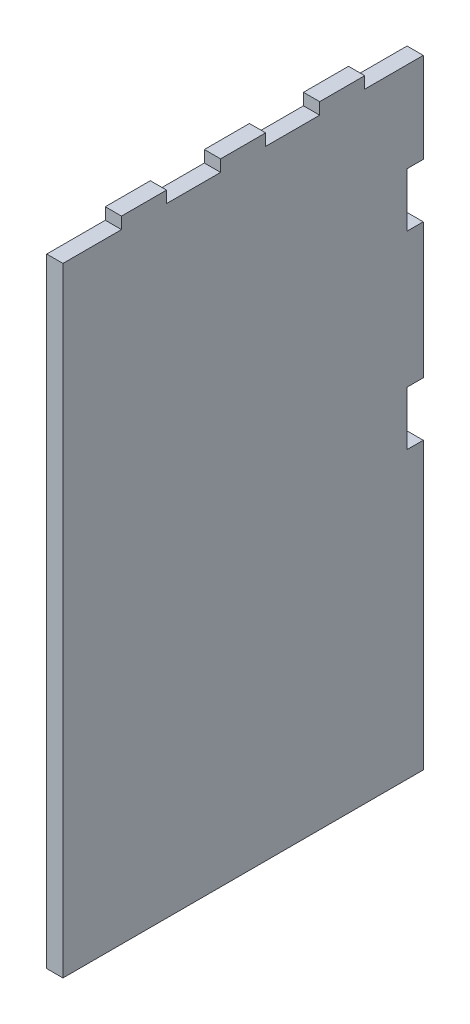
SolidWorks part; units mm, degrees
ref_plane "Front Plane" through (0, 0, 0) normal (0, 0, 1) x (1, 0, 0)
ref_plane "Top Plane" through (0, 0, 0) normal (0, 1, 0) x (1, 0, 0)
ref_plane "Right Plane" through (0, 0, 0) normal (1, 0, 0) x (0, 0, -1)
sketch "Sketch1" plane through (0, 0, 0) normal (1, 0, 0) x (0, 0, -1)
  line L1 (200, -350) -> (-200, -350)
  line L2 (200, -350) -> (200, 350)
  line L3 (200, 350) -> (-200, 350)
  line L4 (-200, -350) -> (-200, 350)
  line L5 (200, -350) -> (-200, 350) construction
  line L6 (200, 350) -> (-200, -350) construction
  point P0 (0, 0)
  dimension "D1" = 400
  dimension "D2" = 700
extrude "Boss-Extrude1" add sketch "Sketch1" along normal blind 18
sketch "Sketch2" plane through (0, 0, 0) normal (1, 0, 0) x (0, 0, -1)
  line L0 (200, 350) -> (-200, 350) construction
  line L1 (-135, 350) -> (-85, 350)
  line L2 (-135, 350) -> (-135, 337)
  line L4 (-85, 350) -> (-85, 337)
  line L5 (200, -350) -> (200, 350) construction
  line L6 (-25, 350) -> (25, 350)
  line L7 (-25, 350) -> (-25, 337)
  line L8 (-135, 337) -> (-200, 337)
  line L9 (25, 350) -> (25, 337)
  line L10 (85, 350) -> (135, 350)
  line L11 (85, 350) -> (85, 337)
  line L12 (-135, 337) -> (-135, 350)
  line L13 (135, 350) -> (135, 337)
  line L14 (-200, 350) -> (-200, -350) construction
  line L15 (-135, 350) -> (-200, 350)
  line L16 (-200, 337) -> (-200, 350)
  line L17 (-85, 337) -> (-25, 337)
  line L18 (-85, 337) -> (-85, 350)
  line L19 (-85, 350) -> (-25, 350)
  line L20 (-25, 337) -> (-25, 350)
  line L21 (25, 337) -> (85, 337)
  line L22 (25, 337) -> (25, 350)
  line L23 (25, 350) -> (85, 350)
  line L24 (85, 337) -> (85, 350)
  line L25 (135, 337) -> (200, 337)
  line L26 (135, 337) -> (135, 350)
  line L27 (135, 350) -> (200, 350)
  line L28 (200, 337) -> (200, 350)
  point P16 (-135, 343.5)
  point P19 (-200, 0)
  dimension "D1" = 65
  dimension "D2" = 50
  dimension "D3" = 60
  dimension "D4" = 65
  dimension "D5" = 13
extrude "Cut-Extrude1" cut sketch "Sketch2" along normal blind 18 contours L16 L8 L2 L15 | L19 L4 L17 L7 | L23 L9 L21 L11 | L25 L28 L27 L13
sketch "Sketch3" plane through (0, 0, 0) normal (1, 0, 0) x (0, 0, -1)
  line L0 (200, -350) -> (200, 337) construction
  line L1 (200, 237) -> (182, 237)
  line L2 (200, 237) -> (200, 177)
  line L3 (200, 177) -> (182, 177)
  line L4 (182, 237) -> (182, 177)
  line L6 (200, 27) -> (182, 27)
  line L7 (200, 27) -> (200, -33)
  line L8 (200, -33) -> (182, -33)
  line L9 (182, 27) -> (182, -33)
  line L10 (135, 337) -> (200, 337) construction
  point P10 (191, 237)
  dimension "D1" = 150
  dimension "D2" = 18
  dimension "D3" = 60
  dimension "D4" = 100
extrude "Cut-Extrude3" cut sketch "Sketch3" along normal blind 18
